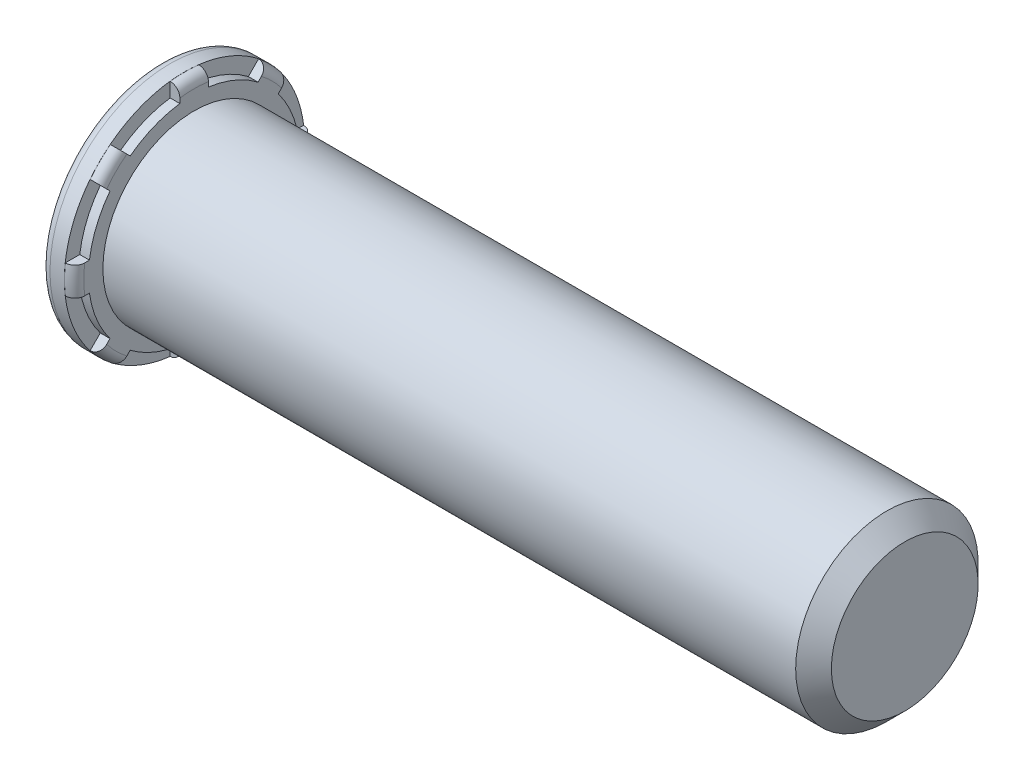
SolidWorks part; units mm, degrees
ref_plane "Plane1" through (0, 0, 0) normal (0, 0, 1) x (1, 0, 0)
ref_plane "Plane2" through (0, 0, 0) normal (0, 1, 0) x (1, 0, 0)
ref_plane "Plane3" through (0, 0, 0) normal (1, 0, 0) x (0, 0, -1)
sketch "BodySke" plane through (0, 0, 0) normal (0, 0, 1) x (1, 0, 0)
  line L0 (-0.635, 2.921) -> (-0.635, 0)
  line L1 (0.2565, 2.9185) -> (0.2565, 2.413)
  line L3 (0.2565, 2.413) -> (18.5776, 2.413)
  line L4 (19.05, 1.9406) -> (19.05, 0)
  line L5 (19.05, 0) -> (-0.635, 0)
  line L6 (0, 0) -> (50.554, 0) construction
  line L8 (19.05, 1.9406) -> (18.5776, 2.413)
  line L9 (-0.381, 3.175) -> (0, 3.175)
  line L10 (0.0025, 3.1725) -> (0, 3.1725)
  line L11 (0.7925, 19.05) -> (0.7925, -3.175) construction
  line L12 (0, 3.1725) -> (0, 3.175)
  arc A0 (-0.635, 2.921) -> (-0.381, 3.175) centre (-0.381, 2.921) cw
  arc A1 (0.0025, 3.1725) -> (0.2565, 2.9185) centre (0.0025, 2.9185) cw
  dimension "D2" = 0.0025
  dimension "Fillet_rad" = 0.254
  dimension "Diameter" = 4.826
  dimension "D3" = 0.0025
  dimension "Length" = 19.05
  dimension "Body_ch_ang" = 45
  dimension "Minor_dia" = 3.8811
  dimension "Advance" = 0.7925
  dimension "H_dia" = 6.35
  dimension "T_dim" = 0.635
revolve "BaseBody" add sketch "BodySke" angle 360 about L6
sketch "ThdSchSke" plane through (0, 0, 0) normal (0, 0, 1) x (1, 0, 0)
  line L0 (2.286, -1.9406) -> (1.9552, -2.413)
  line L1 (2.286, -1.9406) -> (2.6168, -2.413)
  line L2 (2.6168, -2.413) -> (2.6168, -3.0162)
  line L3 (-3.175, 0) -> (5.1513, 0) construction
  line L4 (0, -3.175) -> (0, 3.175) construction
  line L5 (2.6168, -3.0162) -> (1.9552, -3.0162)
  line L6 (1.9552, -3.0162) -> (1.9552, -2.413)
  dimension "Thread_minor" = 3.8811
  dimension "Diameter" = 4.826
  dimension "Start" = 2.286
  dimension "SideAngle" = 55
  dimension "VeeAngle" = 70
  dimension "Overcut" = 6.0325
revolve "ThreadSchematic" [suppressed] cut sketch "ThdSchSke" angle 360 about L3
pattern_linear "ThdSchPat" [suppressed]
sketch "RibCutSke" plane through (0.2565, 1.7944, -0.091) normal (1, 0, 0) x (0, 0, -1)
  line L0 (0.2865, 0.974) -> (0.2865, 1.3581)
  line L1 (1.5997, 0.4301) -> (1.8713, 0.7017)
  line L2 (0.2865, 0.5889) -> (0.2865, 2.4006) construction
  line L3 (-0.091, -1.7944) -> (-0.091, 5.0239) construction
  line L4 (-0.091, -1.7944) -> (0.2865, 0.5889) construction
  line L5 (-0.091, -1.7944) -> (1.3274, 0.1578) construction
  line L6 (1.3274, 0.1578) -> (2.6135, 1.4439) construction
  circle A0 centre (-0.091, -1.7944) radius 2.9185 construction
  arc A1 (1.5997, 0.4301) -> (0.2865, 0.974) centre (-0.091, -1.7944) ccw
  arc A2 (1.8713, 0.7017) -> (0.2865, 1.3581) centre (-0.091, -1.7944) ccw
  circle A4 centre (-0.091, -1.7944) radius 2.413 construction
  dimension "Inner_dia" = 5.588
  dimension "Outer_dia" = 6.35
  dimension "Rib_root_dia" = 4.826
  dimension "Rib_root_half_angle" = 9
  dimension "Rib_root_gap_angle" = 27
  dimension "Angle" = 45
extrude "RibCut" cut sketch "RibCutSke" against normal blind 0.2565
pattern_circular "RibCutsPat" count 8 every 45 about axis through (0, 0, 0) along (1, 0, 0) of "RibCut"
equation "' \"Length@BodySke\" = 0.75"
equation "' \"H_dia@BodySke\" = 0.25"
equation "' \"Start@ThdSchSke\" = 0.09"
equation "' \"T_dim@BodySke\" = 0.025"
equation "' \"Diameter@BodySke\" = 0.19"
equation "' \"Minor_dia@BodySke\" = 0.1528"
equation "' \"Advance@BodySke\" = 0.0312"
equation "\"Fillet_rad@BodySke\" =  \"T_dim@BodySke\" * 0.4"
equation "\"Num_ribs@RibCutsPat\" = 8"
equation "\"Angle@RibCutSke\" =\"Angle@RibCutsPat\""
equation "\"Rib_root_half_angle@RibCutSke\" = \"Angle@RibCutSke\" / 5"
equation "\"Rib_root_gap_angle@RibCutSke\" = \"Angle@RibCutSke\" - (2 * \"Rib_root_half_angle@RibCutSke\" )"
equation "\"Rib_root_dia@RibCutSke\" = \"Diameter@BodySke\""
equation "\"Inner_dia@RibCutSke\" = ( \"H_dia@BodySke\" + \"Diameter@BodySke\" ) / 2"
equation "\"Outer_dia@RibCutSke\" = \"H_dia@BodySke\""
equation "\"Depth@RibCut\" =  \"Fillet_rad@BodySke\" + 0.0001"
equation "\"Thread_length@ThreadCosmetic\" = \"Length@BodySke\" - \"Start@ThdSchSke\""
equation "\"Thread_minor@ThreadCosmetic\" = \"Minor_dia@BodySke\""
equation "\"Thread_minor@ThdSchSke\" = \"Minor_dia@BodySke\""
equation "\"Diameter@ThdSchSke\" = \"Diameter@BodySke\""
equation "\"Overcut@ThdSchSke\" = \"Diameter@BodySke\" * 1.25"
equation "\"Num_threads@ThdSchPat\" = int( \"Thread_length@ThreadCosmetic\" / \"Advance@BodySke\" + 0.999 )  + 1"
equation "\"Advance@ThdSchPat\" = \"Thread_length@ThreadCosmetic\" /  (\"Num_threads@ThdSchPat\" - 1) 'relax it"
equation "\"Num_threads@ThdSchPat\" = \"Num_threads@ThdSchPat\" - sgn( \"Num_threads@ThdSchPat\" - 1) '---chamfered tips only---"
